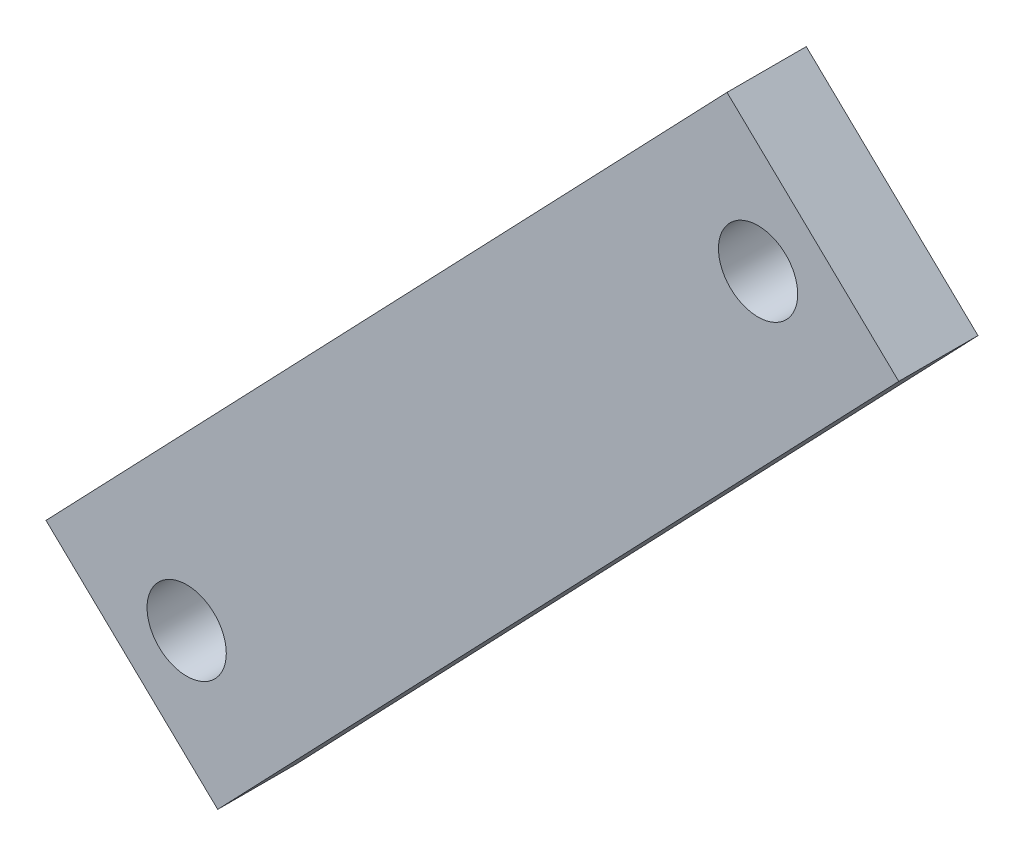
SolidWorks part; units mm, degrees
ref_plane "Ebene vorne" through (0, 0, 0) normal (0, 0, 1) x (1, 0, 0)
ref_plane "Ebene oben" through (0, 0, 0) normal (0, 1, 0) x (1, 0, 0)
ref_plane "Ebene rechts" through (0, 0, 0) normal (1, 0, 0) x (0, 0, -1)
sketch "Skizze1" plane through (0, 0, 0) normal (0, 0, 1) x (1, 0, 0)
  line L1 (-128.8593, 624.31) -> (-42.9287, 714.0495)
  line L2 (-128.8593, 624.31) -> (-107.1912, 603.5616)
  line L3 (-107.1912, 603.5616) -> (-21.2606, 693.3011)
  line L4 (-42.9287, 714.0495) -> (-21.2606, 693.3011)
  circle A0 centre (-111.1091, 621.1584) radius 5
  circle A1 centre (-39.0108, 696.4526) radius 5
  circle A2 centre (-39.0108, 696.4526) radius 5 construction
  circle A3 centre (-111.1091, 621.1584) radius 5 construction
  dimension "D3" = 10
  dimension "D4" = 10
  dimension "D1" = 30
  dimension "D2" = 15
  dimension "D5" = 10
  dimension "D7" = 15
  dimension "D8" = 10
extrude "Linear austragen1" add sketch "Skizze1" along normal blind 10
